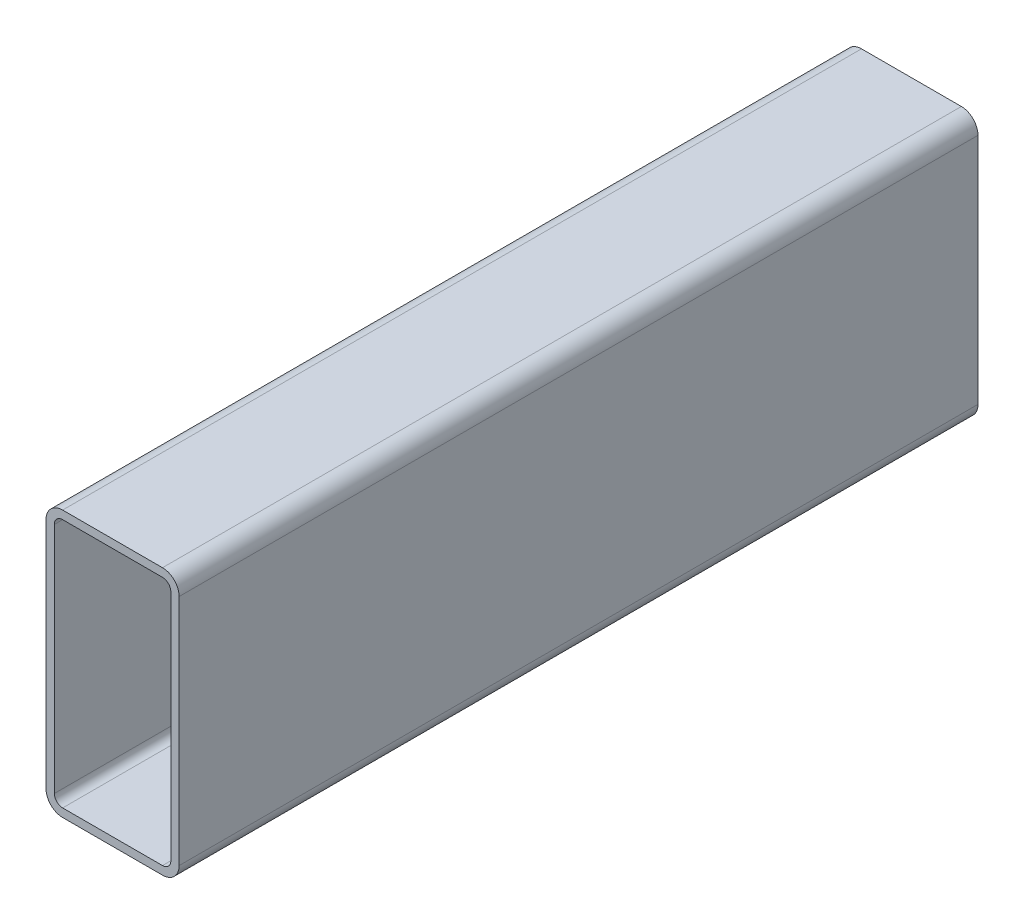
SolidWorks part; units mm, degrees
ref_plane "Front Plane" through (0, 0, 0) normal (0, 0, 1) x (1, 0, 0)
ref_plane "Top Plane" through (0, 0, 0) normal (0, 1, 0) x (1, 0, 0)
ref_plane "Right Plane" through (0, 0, 0) normal (1, 0, 0) x (0, 0, -1)
sketch "Sketch1" plane through (0, 0, 0) normal (0, 0, 1) x (1, 0, 0)
  line B0 (6.35, 101.6) -> (44.45, 101.6)
  arc B1 (50.8, 95.25) -> (44.45, 101.6) centre (44.45, 95.25) ccw
  line B2 (50.8, 95.25) -> (50.8, 6.35)
  arc B3 (44.45, 0) -> (50.8, 6.35) centre (44.45, 6.35) ccw
  line B4 (44.45, 0) -> (6.35, 0)
  arc B5 (0, 6.35) -> (6.35, 0) centre (6.35, 6.35) ccw
  line B6 (0, 6.35) -> (0, 95.25)
  arc B7 (6.35, 101.6) -> (0, 95.25) centre (6.35, 95.25) ccw
  line B8 (6.35, 98.425) -> (44.45, 98.425)
  arc B9 (47.625, 95.25) -> (44.45, 98.425) centre (44.45, 95.25) ccw
  line B10 (47.625, 95.25) -> (47.625, 6.35)
  arc B11 (44.45, 3.175) -> (47.625, 6.35) centre (44.45, 6.35) ccw
  line B12 (44.45, 3.175) -> (6.35, 3.175)
  arc B13 (3.175, 6.35) -> (6.35, 3.175) centre (6.35, 6.35) ccw
  line B14 (3.175, 6.35) -> (3.175, 95.25)
  arc B15 (6.35, 98.425) -> (3.175, 95.25) centre (6.35, 95.25) ccw
sketch_block_instance "HSS4x2x0.125-1"
sketch_block "HSS4x2x0.125"
extrude "Boss-Extrude1" add sketch "Sketch1" along normal blind 304.8
